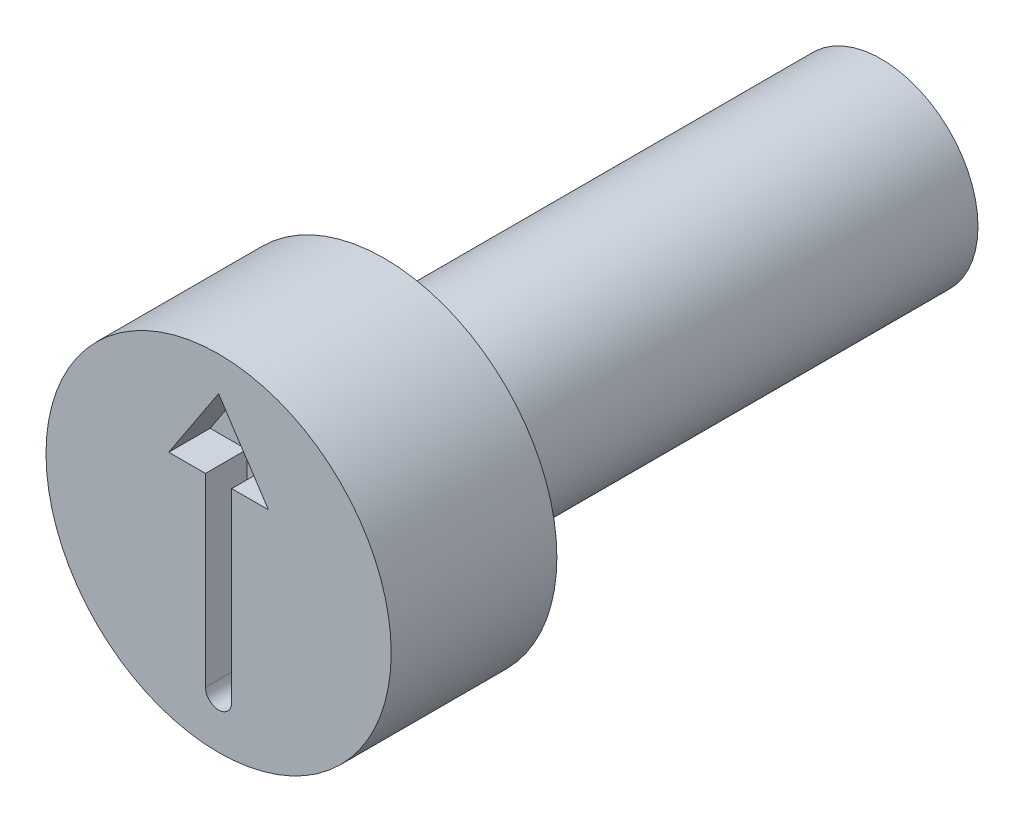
SolidWorks part; units mm, degrees
ref_plane "Front Plane" through (0, 0, 0) normal (0, 0, 1) x (1, 0, 0)
ref_plane "Top Plane" through (0, 0, 0) normal (0, 1, 0) x (1, 0, 0)
ref_plane "Right Plane" through (0, 0, 0) normal (1, 0, 0) x (0, 0, -1)
sketch "Sketch2" plane through (0, 0, 0) normal (1, 0, 0) x (0, 0, -1)
  line L0 (0.4039, 0) -> (50000.4039, 0) construction
  line L6 (0, 1.25) -> (0, 0)
  line L7 (1.2, 1.25) -> (0, 1.25)
  line L8 (1.2, 0.7) -> (1.2, 1.25)
  line L9 (4.8, 0.7) -> (1.2, 0.7)
  line L10 (4.8, 0) -> (4.8, 0.7)
  line L11 (0, 0) -> (4.8, 0)
  dimension "D1" = 2.5
  dimension "D2" = 1.4
  dimension "D3" = 4.8
  dimension "D4" = 1.2
revolve "Revolve1" add sketch "Sketch2" angle 360 about L0
sketch "Sketch3" plane through (0, 0, 0) normal (0, 0, 1) x (1, 0, 0)
  line L0 (0, 0) -> (0, 50000) construction
  line L1 (0.0952, 0.4532) -> (0.0952, -0.8881)
  line L2 (0.361, 0.4532) -> (0.0952, 0.4532)
  line L3 (0, 1.0011) -> (0.361, 0.4532)
  line L15 (0, 1.0011) -> (-0.361, 0.4532)
  line L16 (-0.361, 0.4532) -> (-0.0952, 0.4532)
  line L17 (-0.0952, 0.4532) -> (-0.0952, -0.8881)
  arc A2 (-0.0952, -0.8881) -> (0.0952, -0.8881) centre (0, -0.8881) ccw
extrude "Cut-Extrude4" cut sketch "Sketch3" against normal blind 0.3
